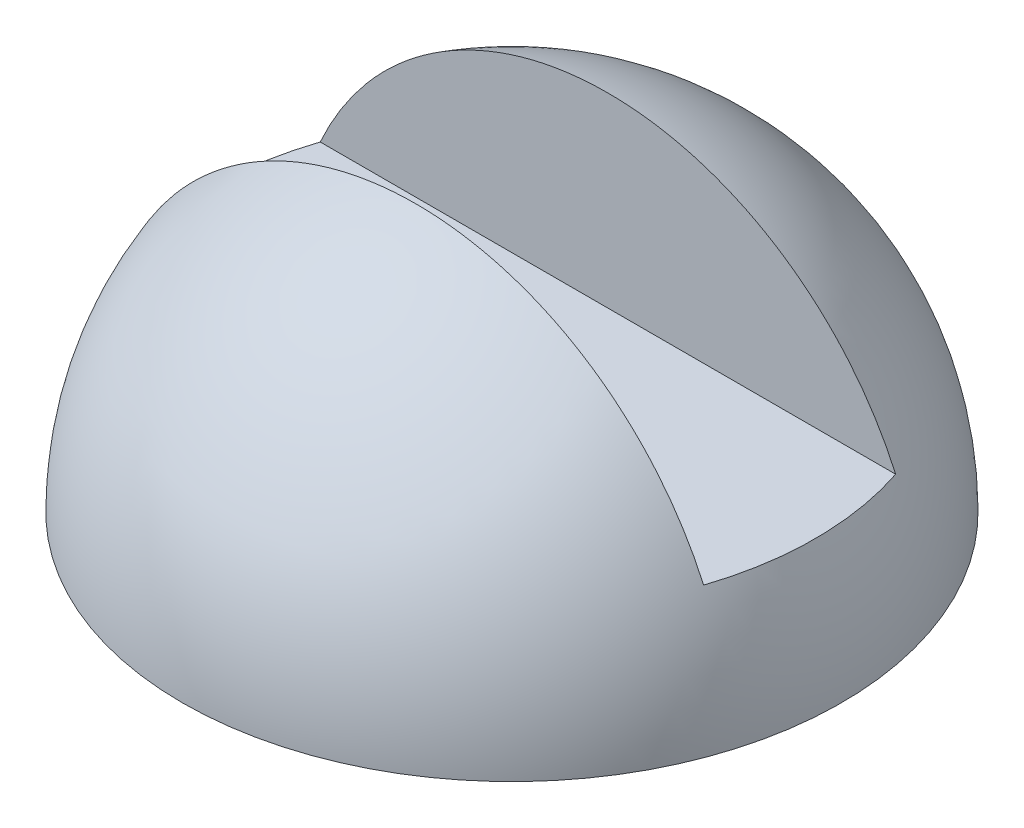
SolidWorks part; units mm, degrees
ref_plane "前视基准面" through (0, 0, 0) normal (0, 0, 1) x (1, 0, 0)
ref_plane "上视基准面" through (0, 0, 0) normal (0, 1, 0) x (1, 0, 0)
ref_plane "右视基准面" through (0, 0, 0) normal (1, 0, 0) x (0, 0, -1)
sketch "草图1" plane through (0, 0, 0) normal (0, 0, 1) x (1, 0, 0)
  line L0 (0, 60.1372) -> (0, -22.4215) construction
  line L1 (-30.0685, 0) -> (0, 0)
  line L2 (0, 0) -> (0, 30.0685)
  arc A0 (0, 30.0685) -> (-30.0685, 0) centre (0, 0) ccw
revolve "旋转1" add sketch "草图1" angle 360 about L0
sketch "草图3" plane through (0, 0, 0) normal (1, 0, 0) x (0, 0, -1)
  line L0 (0, 34.1267) -> (0, -3.2899) construction
  line L1 (8.7587, 11.7689) -> (-8.7587, 11.7689)
  line L2 (-8.7587, 11.7689) -> (-8.7587, 31.284)
  line L3 (-8.7587, 31.284) -> (8.7587, 31.284)
  line L4 (8.7587, 11.7689) -> (8.7587, 31.284)
  point P8 (0, 11.7689)
  point P9 (0, 31.284)
extrude "切除-拉伸1" cut sketch "草图3" against normal mid plane 70
